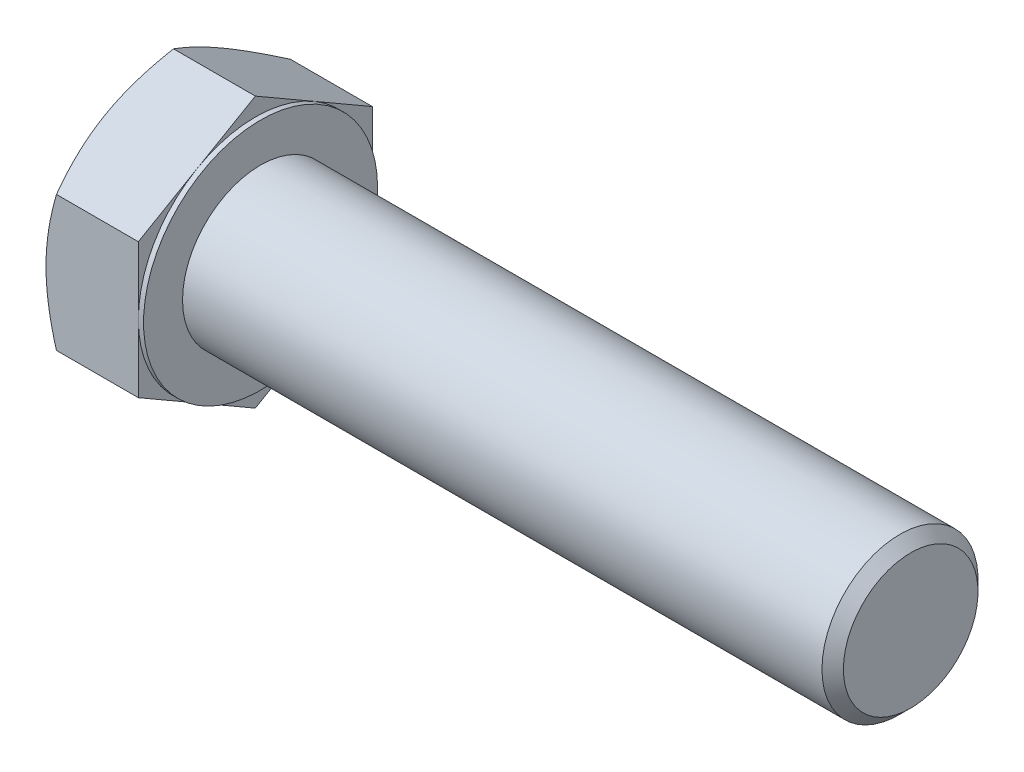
SolidWorks part; units mm, degrees
extrude "BaseHead" add sketch "Sketch1" along normal blind 15
sketch "Sketch1" plane through (0, 0, 0) normal (1, 0, 0) x (0, 0, -1)
  line L0 (18, 10.3923) -> (18, -10.3923)
  line L1 (-18, 10.3923) -> (-18, -10.3923)
  line L2 (18, -10.3923) -> (0, -20.7846)
  line L3 (0, -20.7846) -> (-18, -10.3923)
  line L4 (18, 10.3923) -> (0, 20.7846)
  line L5 (0, 20.7846) -> (-18, 10.3923)
revolve "HeadChamfer" cut sketch "Sketch3" angle 360 about L6
sketch "Sketch3" plane through (0, 0, 0) normal (0, 0, 1) x (1, 0, 0)
  line L0 (0, 18) -> (4.4944, 25.7846)
  line L1 (0, 20.7846) -> (0, 10.3923) construction
  line L2 (4.4944, 25.7846) -> (4.4944, 30.7846)
  line L3 (4.4944, 30.7846) -> (-10, 30.7846)
  line L4 (-10, 30.7846) -> (-10, 18)
  line L5 (-10, 18) -> (0, 18)
  line L6 (0, 0) -> (99.06, 0) construction
  line L7 (15, 20.7846) -> (0, 20.7846) construction
ref_plane "Plane1" through (0, 0, 0) normal (0, 0, 1) x (1, 0, 0)
ref_plane "Plane2" through (0, 0, 0) normal (0, 1, 0) x (1, 0, 0)
ref_plane "Plane3" through (0, 0, 0) normal (1, 0, 0) x (0, 0, -1)
sketch "BodySke" plane through (0, 0, 0) normal (0, 0, 1) x (1, 0, 0)
  line L0 (0, 10.3923) -> (0, -10.3923) construction
  line L1 (0, 0) -> (115, 0)
  line L2 (0, 0) -> (0, 12)
  line L3 (0, 12) -> (113.352, 12)
  line L4 (115, 0) -> (115, 10.352)
  line L5 (15, 20.7846) -> (15, 10.3923) construction
  line L6 (115, 10.352) -> (113.352, 12)
  line L7 (0, 0) -> (96.52, 0) construction
  line L8 (115, -10.352) -> (113.352, -12) construction
  line L9 (0, -12) -> (113.352, -12) construction
  line L10 (18, 15.24) -> (18, -1.27) construction
  line L11 (61, 15.24) -> (61, -1.27) construction
  line L12 (15, 10.3923) -> (15, -10.3923) construction
revolve "BaseBody" add sketch "BodySke"
fillet "HeadFillet" [suppressed] radius 0.8
sketch "Sketch4" plane through (0, 0, 0) normal (0, 0, 1) x (1, 0, 0)
  line L1 (15, 20.7846) -> (15, 10.3923) construction
  line L2 (15, 18) -> (14.2, 18)
  line L3 (15, 18) -> (15, 30.7846)
  line L4 (15, 30.7846) -> (14.2, 30.7846)
  line L5 (0, 0) -> (95.25, 0) construction
  line L6 (0, 0) -> (96.52, 0) construction
  line L7 (14.2, 18) -> (14.2, 30.7846)
  line L8 (15, 20.7846) -> (1.6077, 20.7846) construction
revolve "BearingFace" cut sketch "Sketch4" angle 360 about L5
sketch "ThdSchSke" plane through (0, 0, 0) normal (0, 0, 1) x (1, 0, 0)
  line L0 (61, -10.352) -> (59.8461, -12)
  line L1 (61, -10.352) -> (62.1539, -12)
  line L2 (62.1539, -12) -> (62.1539, -15)
  line L3 (-3.175, 0) -> (5.1513, 0) construction
  line L5 (62.1539, -15) -> (59.8461, -15)
  line L6 (59.8461, -15) -> (59.8461, -12)
revolve "ThreadSchematic" [suppressed] cut sketch "ThdSchSke" angle 360 about L3
pattern_linear "ThdSchPat" [suppressed]
equation "\"D3@Sketch1\" = \"Width_flats@Sketch1\" / 2"
equation "\"D4@Sketch1\" = \"D3@Sketch1\""
equation "\"D5@Sketch1\" = \"D4@Sketch1\""
equation "\"Thread_minor@ThreadCosmetic\" = \"Minor_dia@BodySke\""
equation "\"D1@Sketch3\" = \"Width_flats@Sketch1\" / 2"
equation "\"D1@Sketch4\" = \"Width_flats@Sketch1\""
equation "\"Thread_length@ThreadCosmetic\" = ((sgn( (\"Length@BodySke\" - \"Advance@BodySke\" ) - \"Thread_nom@BodySke\" )-1)*( (\"Length@BodySke\" - \"Advance@BodySke\" ) - \"Thread_nom@BodySke\" ))/-2+ \"Thread_nom@BodySke\""
equation "\"Thread_minor@ThdSchSke\" = \"Minor_dia@BodySke\""
equation "\"Diameter@ThdSchSke\" = \"Diameter@BodySke\""
equation "\"Overcut@ThdSchSke\" = \"Diameter@BodySke\" * 1.25"
equation "\"Start@ThdSchSke\" = \"Head_ht@BaseHead\" + \"Length@BodySke\" - \"Thread_length@ThreadCosmetic\"  '---Non-countersunk---"
equation "\"Num_threads@ThdSchPat\" = int( \"Thread_length@ThreadCosmetic\" / \"Advance@BodySke\" + 0.999 )  + 1"
equation "\"Advance@ThdSchPat\" = \"Thread_length@ThreadCosmetic\" /  (\"Num_threads@ThdSchPat\" - 1) 'relax it"
equation "\"Num_threads@ThdSchPat\" = \"Num_threads@ThdSchPat\" - sgn( \"Num_threads@ThdSchPat\" - 1) '---chamfered tips only---"
